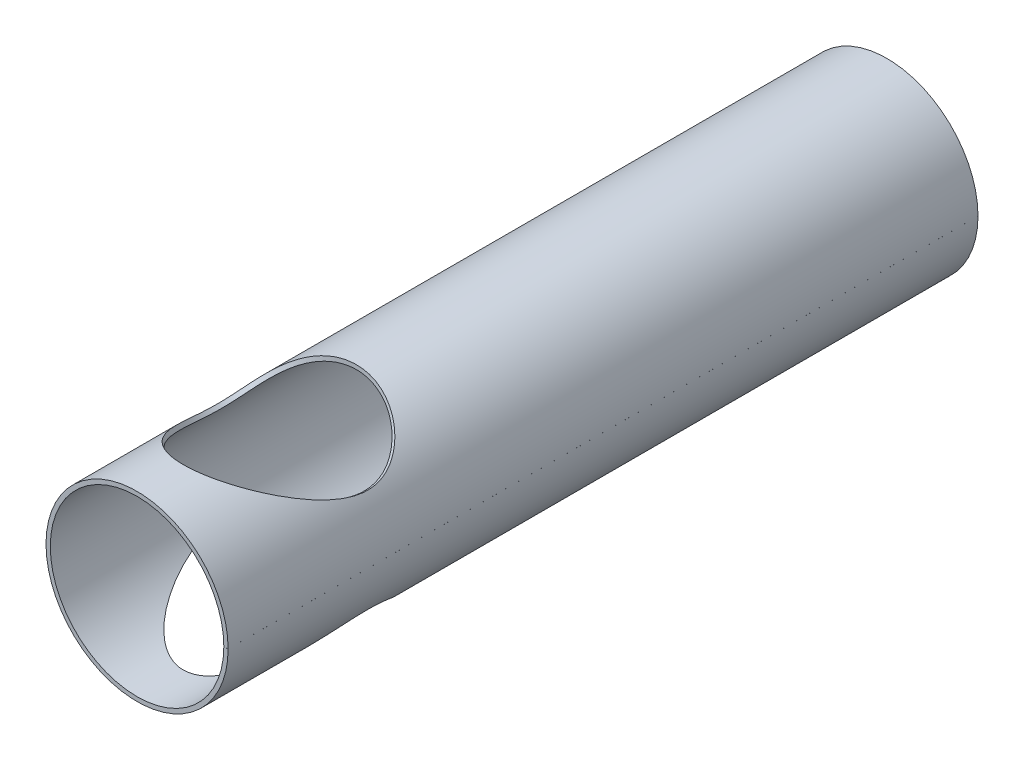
SolidWorks part; units mm, degrees
ref_plane "Ebene vorne" through (0, 0, 0) normal (0, 0, 1) x (1, 0, 0)
ref_plane "Ebene oben" through (0, 0, 0) normal (0, 1, 0) x (1, 0, 0)
ref_plane "Ebene rechts" through (0, 0, 0) normal (1, 0, 0) x (0, 0, -1)
imported_body "Importiert1"
sketch "Skizze1" plane through (0, 0, 175) normal (0, 0, 1) x (1, 0, 0)
  line L0 (0, 0) -> (40.5, 0) construction
  line L1 (40.5, 0.005) -> (42.5, 0.005)
  line L2 (40.5, 0.005) -> (40.5, -0.005)
  line L3 (40.5, -0.005) -> (42.5, -0.005)
  line L4 (42.5, 0.005) -> (42.5, -0.005)
  circle A0 centre (0, 0) radius 42.5 construction
  circle A1 centre (0, 0) radius 40.5 construction
  point P9 (0, 0)
  dimension "D1" = 0.01
extrude "Schnitt-Linear austragen1" cut sketch "Skizze1" against normal through all
flatten bends "Abwickeln1" thickness 2 parameters "D1"=0
sketch "Skizze-Winkel1" plane through (42.5, -0.005, 0) normal (1, -0.0001, 0) x (0, 0, -1)
  line L0 (175, -130.3712) -> (-175, -130.3712) construction
bend "Biegung-Rundung1" bend radius 40.5 bend angle 359.987 parameters "D5"=1
process bends "Abbiegen1" thickness 2 parameters "D1"=0
sketch "Abwicklung-Skizze1" plane through (42.5, -0.005, 0) normal (1, -0.0001, 0) x (0, 0, -1)
sketch "Biegung-Linien1" [suppressed] plane through (0, 0, 0) normal (0, 1, 0) x (1, 0, 0)
sketch "Rahmen1" [suppressed] plane through (0, 0, 0) normal (0, 1, 0) x (1, 0, 0)
sheet metal parameters "Blech3" thickness 2 parameters "D1"=1
flat pattern "Abwicklung3"
sketch "Biegung-Linien2" plane through (42.5, -0.005, 0) normal (1, -0.0001, 0) x (0, 0, -1)
  line L0 (175, -130.3712) -> (-175, -130.3712) construction
  line L1 (175, -130.3712) -> (-175, -130.3712) construction
sketch3d "Rahmen2" [suppressed]
  line L0 (-175, 130.3712, 0) -> (175, 130.3712, 0) construction
  line L1 (-175, -130.3712, 0) -> (175, -130.3712, 0) construction
  line L2 (-175, 130.3712, 0) -> (-175, -130.3712, 0) construction
  line L3 (175, 130.3712, 0) -> (175, -130.3712, 0) construction
bend of the flat pattern "Abwickeln-<Biegung-Rundung1>1"
